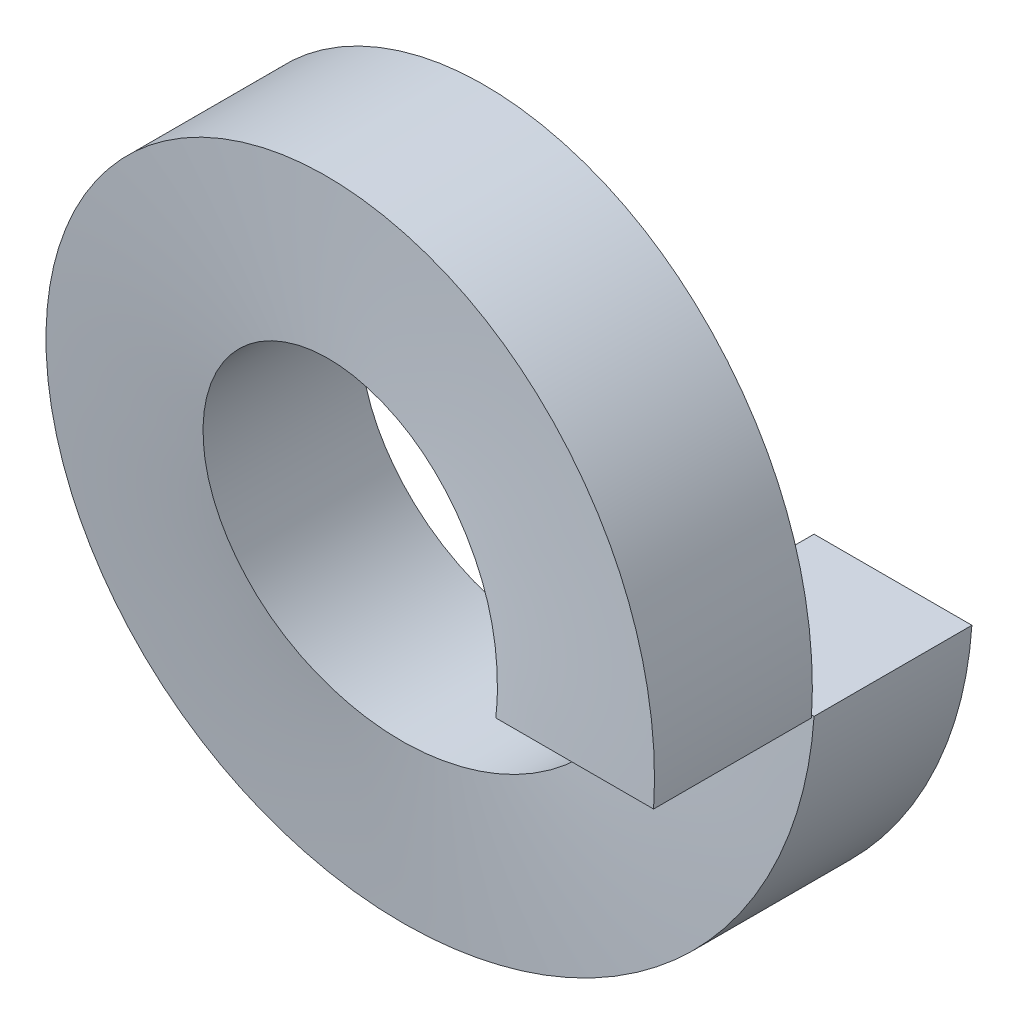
SolidWorks part; units mm, degrees
ref_plane "前视基准面" through (0, 0, 0) normal (0, 0, 1) x (1, 0, 0)
ref_plane "上视基准面" through (0, 0, 0) normal (0, 1, 0) x (1, 0, 0)
ref_plane "右视基准面" through (0, 0, 0) normal (1, 0, 0) x (0, 0, -1)
sketch "草图1" plane through (0, 0, 0) normal (0, 0, 1) x (1, 0, 0)
  circle A0 centre (0, 0) radius 3.05
  dimension "D1" = 6.1
curve "螺旋线/涡状线1"
sketch "草图2" plane through (0, 0, 0) normal (0, 1, 0) x (1, 0, 0)
  line L0 (2.14, 0.91) -> (2.14, -0.91)
  line L1 (2.14, -0.91) -> (3.96, -0.91)
  line L2 (3.96, -0.91) -> (3.96, 0.91)
  line L3 (3.96, 0.91) -> (2.14, 0.91)
  circle A0 centre (3.05, 0) radius 0.91 construction
sweep "扫描1" add profiles "草图2" path "螺旋线/涡状线1"
